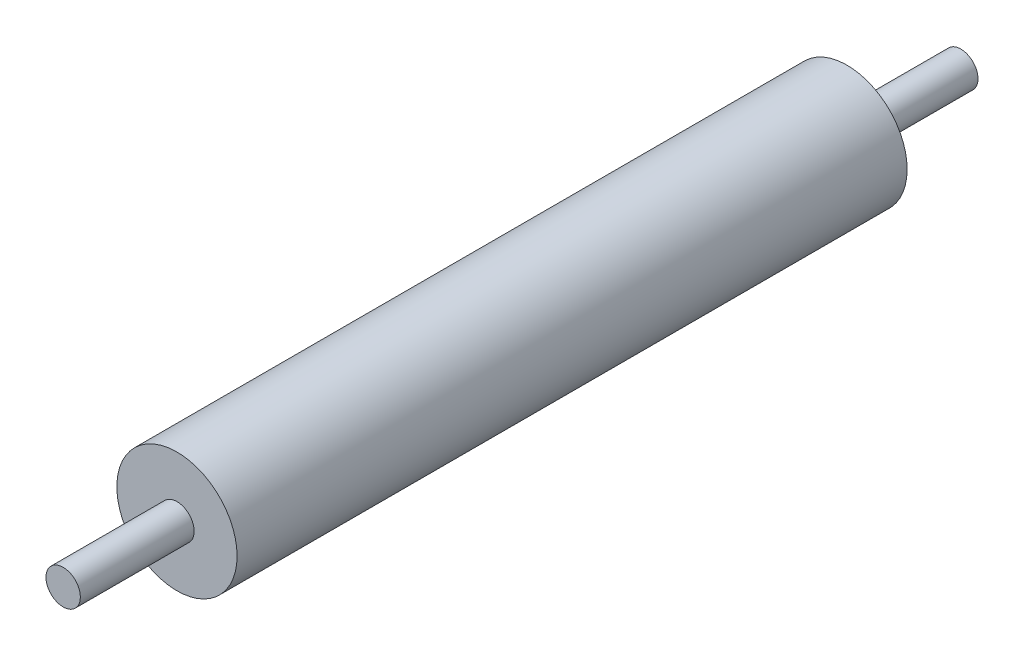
SolidWorks part; units mm, degrees
ref_plane "前视基准面" through (0, 0, 0) normal (0, 0, 1) x (1, 0, 0)
ref_plane "上视基准面" through (0, 0, 0) normal (0, 1, 0) x (1, 0, 0)
ref_plane "右视基准面" through (0, 0, 0) normal (1, 0, 0) x (0, 0, -1)
sketch "草图1" plane through (0, 0, 0) normal (0, 0, 1) x (1, 0, 0)
  circle A0 centre (0, 0) radius 70
  dimension "D1" = 140
extrude "拉伸1" add sketch "草图1" along normal mid plane 780
sketch "草图2" plane through (0, 0, 390) normal (0, 0, 1) x (1, 0, 0)
  circle A0 centre (0, 0) radius 20
  dimension "D1" = 40
extrude "拉伸2" add sketch "草图2" along normal blind 132.5
sketch "草图3" plane through (0, 0, -390) normal (0, 0, -1) x (-1, 0, 0)
  circle A0 centre (0, 0) radius 20
  dimension "D1" = 40
extrude "拉伸3" add sketch "草图3" along normal blind 132.5
